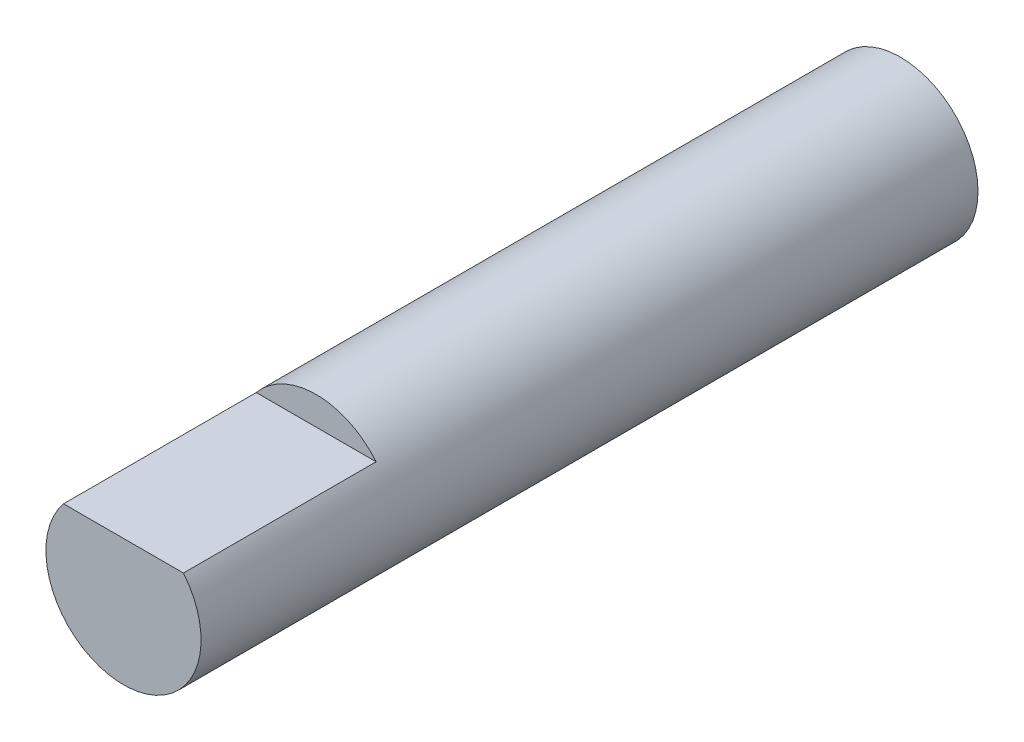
SolidWorks part; units mm, degrees
ref_plane "Front Plane" through (0, 0, 0) normal (0, 0, 1) x (1, 0, 0)
ref_plane "Top Plane" through (0, 0, 0) normal (0, 1, 0) x (1, 0, 0)
ref_plane "Right Plane" through (0, 0, 0) normal (1, 0, 0) x (0, 0, -1)
sketch "Sketch1" plane through (0, 0, 0) normal (0, 0, 1) x (1, 0, 0)
  circle A0 centre (0, 0) radius 3.1699
  dimension "D1" = 6.3398
extrude "Extrude1" add sketch "Sketch1" along normal blind 31.75
sketch "Sketch2" plane through (0, 0, 31.75) normal (0, 0, 1) x (1, 0, 0)
  line L0 (-2.4498, 2.0117) -> (2.4498, 2.0117)
  circle A0 centre (0, 0) radius 3.1699 construction
  arc A1 (2.4498, 2.0117) -> (-2.4498, 2.0117) centre (0, 0) ccw
  dimension "D1" = 5.1816
extrude "Cut-Extrude1" cut sketch "Sketch2" against normal blind 7.874
